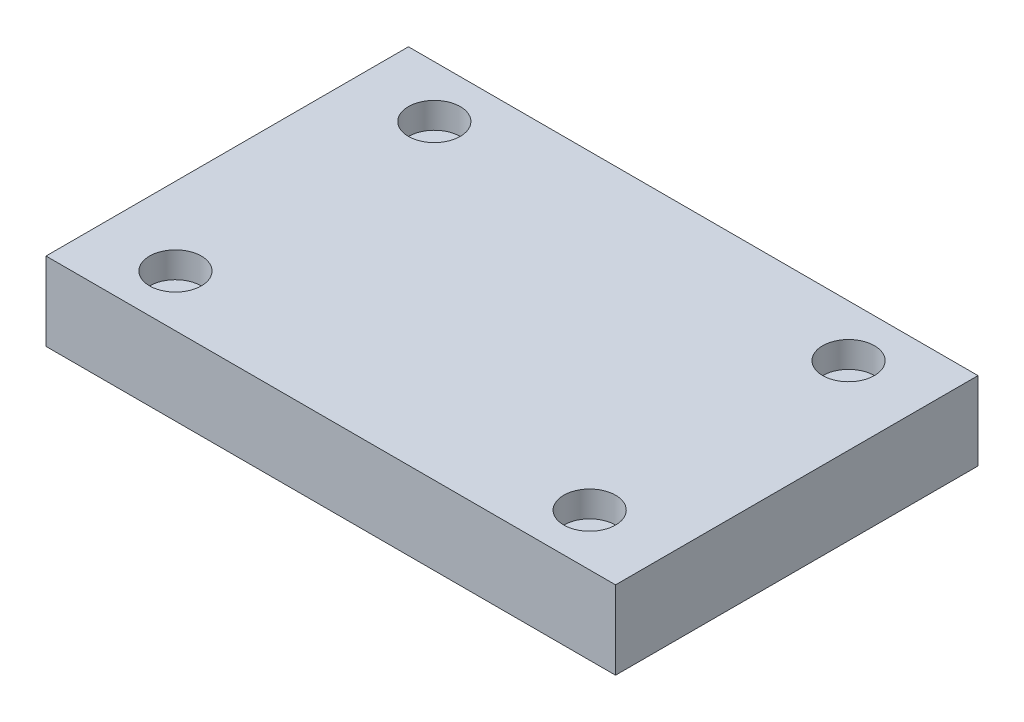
SolidWorks part; units mm, degrees
ref_plane "Front Plane" through (0, 0, 0) normal (0, 0, 1) x (1, 0, 0)
ref_plane "Top Plane" through (0, 0, 0) normal (0, 1, 0) x (1, 0, 0)
ref_plane "Right Plane" through (0, 0, 0) normal (1, 0, 0) x (0, 0, -1)
sketch "Sketch1" plane through (0, 0, 0) normal (0, 1, 0) x (1, 0, 0)
  line L0 (69.85, 44.45) -> (-69.85, -44.45) construction
  line L1 (-69.85, 44.45) -> (69.85, 44.45)
  line L2 (-69.85, 44.45) -> (-69.85, -44.45)
  line L3 (-69.85, -44.45) -> (69.85, -44.45)
  line L4 (69.85, 44.45) -> (69.85, -44.45)
  dimension "D1" = 139.7
  dimension "D2" = 88.9
extrude "Extrude1" add sketch "Sketch1" along normal blind 19.2035
sketch "Sketch2" plane through (0, 19.2035, 0) normal (0, 1, 0) x (-1, 0, 0)
  line L1 (-50.8, 31.75) -> (-1.5231, 31.75) construction
  line L2 (-50.8, -31.75) -> (-9.2843, -31.75) construction
  line L3 (-50.8, 31.75) -> (-50.8, -0.5112) construction
  line L4 (50.8, 31.75) -> (50.8, 1.4508) construction
  circle A0 centre (-50.8, 31.75) radius 6.35
  circle A1 centre (-50.8, -31.75) radius 6.35
  circle A2 centre (50.8, 31.75) radius 6.35
  circle A3 centre (50.8, -31.75) radius 6.35
  dimension "D1" = 12.7
  dimension "D2" = 101.6
  dimension "D3" = 50.8
  dimension "D4" = 31.75
  dimension "D5" = 63.5
extrude "Cut-Extrude1" cut sketch "Sketch2" against normal blind 6.35
